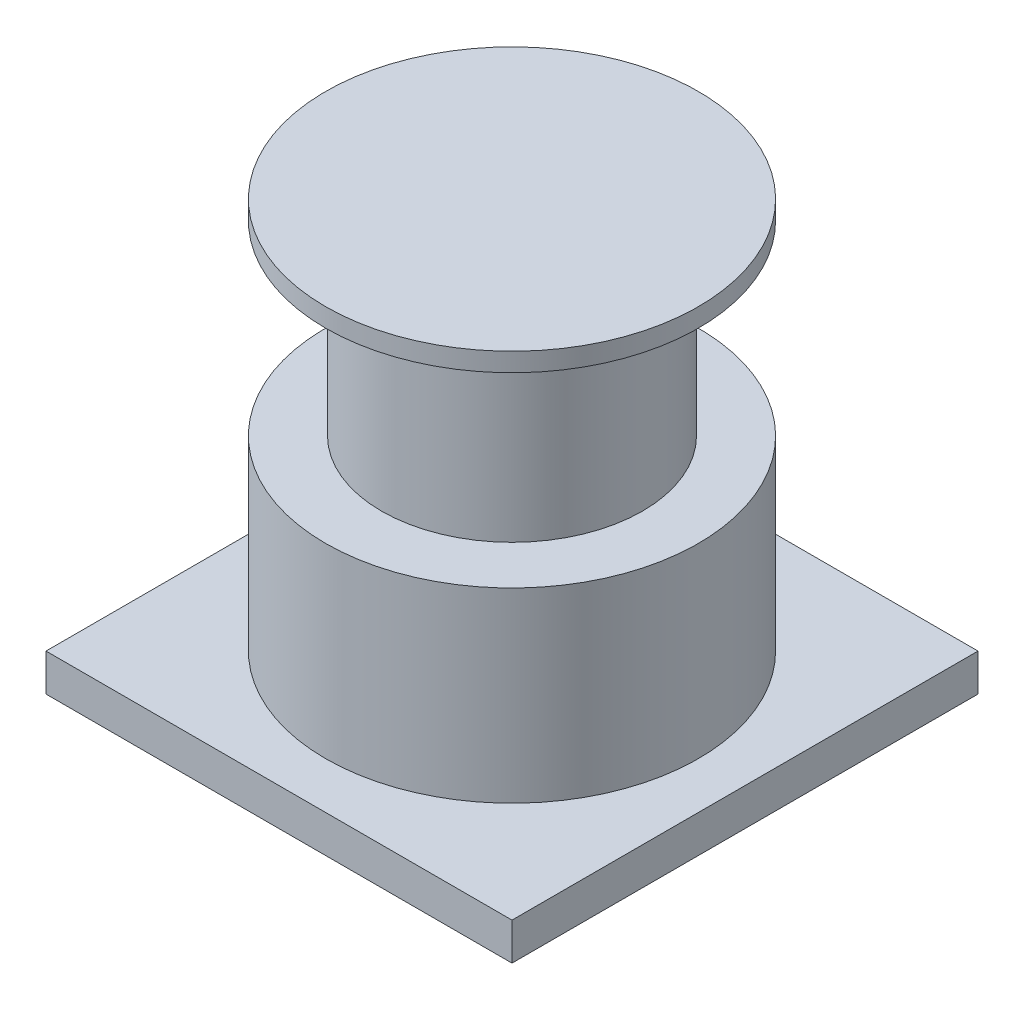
SolidWorks part; units mm, degrees
ref_plane "Front Plane" through (0, 0, 0) normal (0, 0, 1) x (1, 0, 0)
ref_plane "Top Plane" through (0, 0, 0) normal (0, 1, 0) x (1, 0, 0)
ref_plane "Right Plane" through (0, 0, 0) normal (1, 0, 0) x (0, 0, -1)
sketch "Sketch1" plane through (0, 0, 0) normal (0, 1, 0) x (1, 0, 0)
  line L1 (-78.1893, -163.1687) -> (171.8107, -163.1687)
  line L2 (-78.1893, -163.1687) -> (-78.1893, 86.8313)
  line L3 (-78.1893, 86.8313) -> (171.8107, 86.8313)
  line L4 (171.8107, -163.1687) -> (171.8107, 86.8313)
  dimension "D1" = 250
  dimension "D2" = 250
extrude "Boss-Extrude1" add sketch "Sketch1" along normal blind 20
sketch "Sketch2" plane through (0, 20, 0) normal (0, 1, 0) x (1, 0, 0)
  line L0 (171.8107, 86.8313) -> (-78.1893, 86.8313) construction
  line L1 (171.8107, -163.1687) -> (171.8107, 86.8313) construction
  circle A0 centre (46.8107, -38.1687) radius 100
  point P4 (46.8107, 86.8313)
  point P7 (171.8107, -38.1687)
  dimension "D1" = 200
extrude "Boss-Extrude2" add sketch "Sketch2" along normal blind 100
sketch "Sketch3" plane through (0, 120, 0) normal (0, 1, 0) x (1, 0, 0)
  circle A0 centre (46.8107, -38.1687) radius 70
  dimension "D1" = 140
extrude "Boss-Extrude3" add sketch "Sketch3" along normal blind 100
sketch "Sketch4" plane through (0, 220, 0) normal (0, 1, 0) x (1, 0, 0)
  circle A0 centre (46.8107, -38.1687) radius 100
extrude "Boss-Extrude4" add sketch "Sketch4" along normal blind 10
